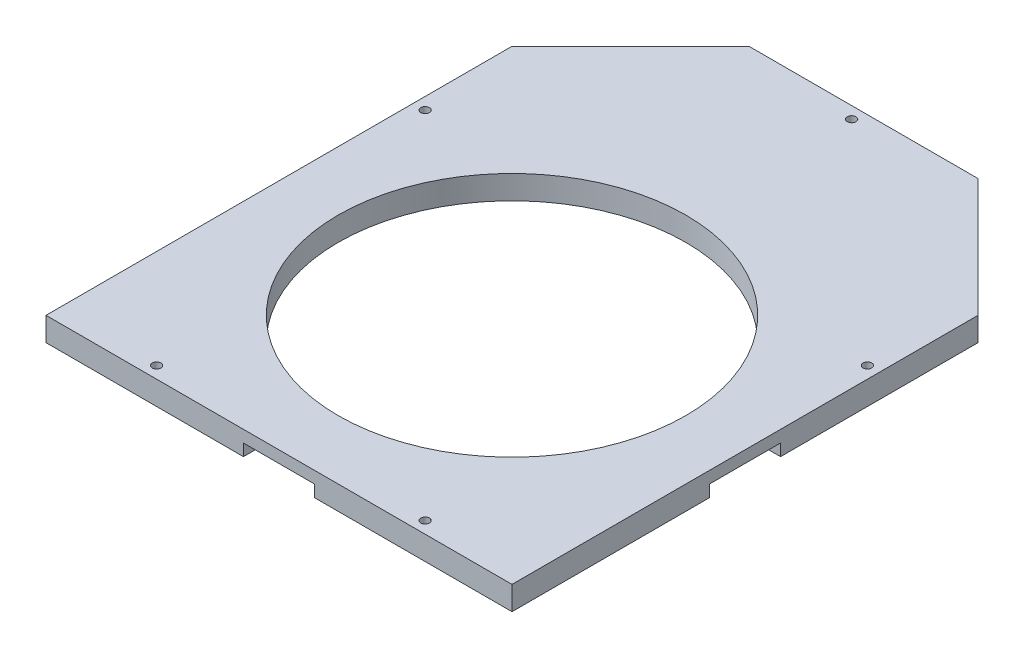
SolidWorks part; units mm, degrees
ref_plane "Plan de face" through (0, 0, 0) normal (0, 0, 1) x (1, 0, 0)
ref_plane "Plan de dessus" through (0, 0, 0) normal (0, 1, 0) x (1, 0, 0)
ref_plane "Plan de droite" through (0, 0, 0) normal (1, 0, 0) x (0, 0, -1)
sketch "Esquisse1" plane through (0, 0, 0) normal (0, 1, 0) x (1, 0, 0)
  line L0 (0, 101.301) -> (0, -77.0945) construction
  line L1 (-59, 59) -> (-29, 89)
  line L2 (-59, 59) -> (-59, -59)
  line L3 (-59, -59) -> (59, -59)
  line L4 (59, 59) -> (59, -59)
  line L5 (-59, 97.3844) -> (-59, -88.3668) construction
  line L6 (-93.3959, 59) -> (76.844, 59) construction
  line L7 (76.844, 0) -> (-81.2306, 0) construction
  line L8 (-53, 52.537) -> (-53, -61.4763) construction
  line L9 (-81.2306, 34) -> (-54.0627, 34) construction
  line L10 (-56, 41.4687) -> (-56, 21.1567) construction
  line L11 (59, 97.3844) -> (59, -88.3668) construction
  line L12 (-93.3959, -59) -> (76.844, -59) construction
  line L13 (-59, 59) -> (-6.7976, 111.2024) construction
  line L14 (-93.3959, 89) -> (65.2474, 89) construction
  line L15 (59, 59) -> (29, 89)
  line L16 (-29, 89) -> (29, 89)
  line L17 (65.2474, 86) -> (-6.7976, 86) construction
  circle A0 centre (0, 0) radius 44
  circle A5 centre (-56, 34) radius 1.1
  circle A6 centre (34, -56) radius 1.1
  circle A7 centre (56, 34) radius 1.1
  circle A8 centre (-34, -56) radius 1.1
  circle A9 centre (34, 56) radius 1.1
  circle A10 centre (56, -34) radius 1.1
  circle A11 centre (0, 86) radius 1.1
  point P42 (0, 0)
  dimension "D1" = 6
  dimension "D2" = 59
  dimension "D7" = 3
  dimension "D8" = 4
  dimension "D3" = 3
  dimension "D4" = 59
  dimension "D5" = 118
  dimension "D6" = 25
  dimension "D9" = 45
  dimension "D10" = 30
extrude "Boss.-Extru.1" add sketch "Esquisse1" along normal blind 6
sketch "Esquisse2" plane through (0, 0, 0) normal (0, 1, 0) x (1, 0, 0)
  line L0 (77.3131, 0) -> (-9.7402, 0) construction
  line L1 (0, -9.452) -> (0, 33.9732) construction
  line L2 (53, -69.5306) -> (53, 18.5373) construction
  line L3 (77.3131, 9) -> (46.0632, 9) construction
  line L4 (53, 9) -> (73.0805, -11.0805) construction
  line L5 (59, -59) -> (59, 59) construction
  line L6 (53, 6.7373) -> (53, -6.7373)
  line L7 (55.2627, 9) -> (61.024, 9)
  line L8 (55.2627, -9) -> (61.024, -9)
  line L9 (61.024, 9) -> (61.024, -9)
  line L10 (6.7373, -53) -> (-6.7373, -53)
  line L11 (9, -55.2627) -> (9, -61.024)
  line L12 (-9, -55.2627) -> (-9, -61.024)
  line L13 (9, -61.024) -> (-9, -61.024)
  line L14 (-53, -6.7373) -> (-53, 6.7373)
  line L15 (-55.2627, -9) -> (-61.024, -9)
  line L16 (-55.2627, 9) -> (-61.024, 9)
  line L17 (-61.024, -9) -> (-61.024, 9)
  line L22 (-6.7373, 53) -> (6.7373, 53)
  line L23 (-9, 55.2627) -> (-9, 61.024)
  line L24 (9, 55.2627) -> (9, 61.024)
  line L25 (-9, 61.024) -> (9, 61.024)
  arc A0 (55.2627, 9) -> (53, 6.7373) centre (54.1314, 7.8686) ccw
  arc A1 (55.2627, -9) -> (53, -6.7373) centre (54.1314, -7.8686) cw
  arc A2 (9, -55.2627) -> (6.7373, -53) centre (7.8686, -54.1314) ccw
  arc A3 (-9, -55.2627) -> (-6.7373, -53) centre (-7.8686, -54.1314) cw
  arc A4 (-55.2627, -9) -> (-53, -6.7373) centre (-54.1314, -7.8686) ccw
  arc A5 (-55.2627, 9) -> (-53, 6.7373) centre (-54.1314, 7.8686) cw
  arc A8 (-9, 55.2627) -> (-6.7373, 53) centre (-7.8686, 54.1314) ccw
  arc A9 (9, 55.2627) -> (6.7373, 53) centre (7.8686, 54.1314) cw
  point P48 (0, 0)
  dimension "D4" = 4
  dimension "D1" = 9
  dimension "D2" = 45
  dimension "D3" = 6
extrude "Enlèv. mat.-Extru.1" cut sketch "Esquisse2" along normal blind 3
